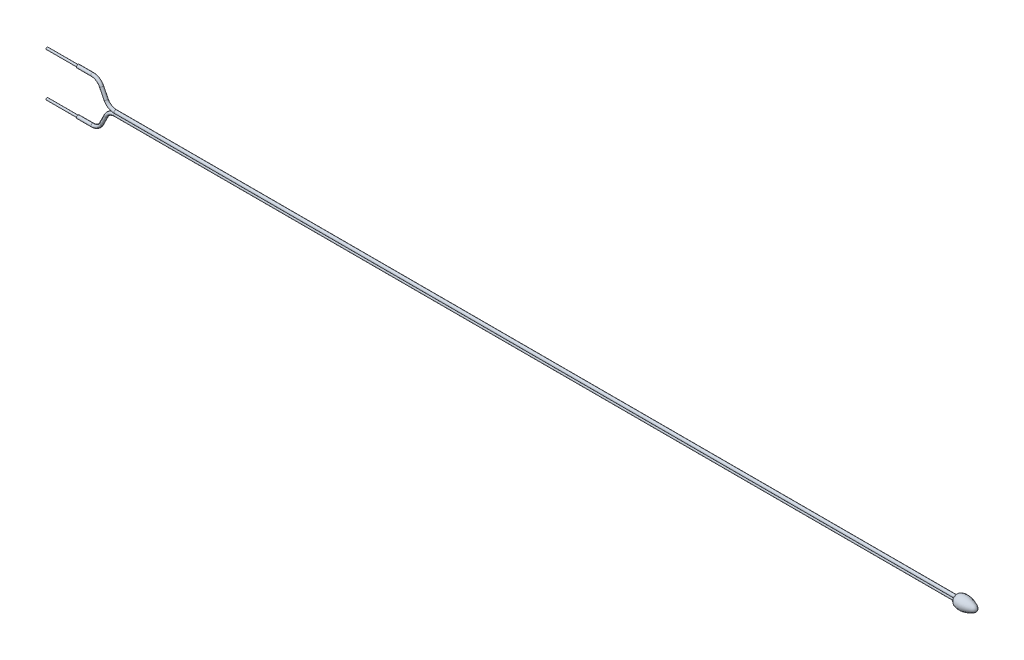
SolidWorks part; units mm, degrees
ref_plane "Спереди" through (0, 0, 0) normal (0, 0, 1) x (1, 0, 0)
ref_plane "Сверху" through (0, 0, 0) normal (0, 1, 0) x (1, 0, 0)
ref_plane "Справа" through (0, 0, 0) normal (1, 0, 0) x (0, 0, -1)
sketch "Эскиз1" plane through (0, 0, 0) normal (0, 0, 1) x (1, 0, 0)
  line L0 (0, 0) -> (0, 0.3)
  line L1 (0, 0) -> (2.1977, 0) construction
  line L2 (2, 0) -> (0, 0)
  spline S0 degree 3 poles (0, 0.3) (0.1151, 0.5518) (0.7679, 0.6612) (1.4471, 0.471) (1.9856, 0.2262) (2, 0) knots 0 0 0 0 0.344144 0.722891 1 1 1 1
  point P5 (0, 0)
  point P7 (0.0643, 0.3367)
  point P9 (0.0803, 0.4179)
  point P11 (0, 0)
  dimension "D1" = 0.3
  dimension "D2" = 2
  dimension "D3" = 0.6
  dimension "D4" = 0.7
revolve "Повернуть1" add sketch "Эскиз1" angle 360 about L1
sketch "Эскиз2" plane through (0, 0, 0) normal (0, 0, 1) x (1, 0, 0)
  line L0 (0, 0.12) -> (-81.382, 0.12)
  line L1 (0, 0.3) -> (0, -0.3) construction
  line L2 (-82.2764, 0.6728) -> (-82.7236, 1.5672)
  line L3 (-83.618, 2.12) -> (-88, 2.12)
  arc A0 (-82.7236, 1.5672) -> (-83.618, 2.12) centre (-83.618, 1.12) ccw
  arc A1 (-81.382, 0.12) -> (-82.2764, 0.6728) centre (-81.382, 1.12) cw
  point P9 (-83, 2.12)
  point P12 (-82, 0.12)
  dimension "D5" = 1
  dimension "D1" = 5
  dimension "D2" = 1
  dimension "D3" = 88
  dimension "D4" = 2
  dimension "D6" = 0.12
sketch "Эскиз3" plane through (0, 0, 0) normal (-1, 0, 0) x (0, 0, 1)
  circle A0 centre (0, 0.12) radius 0.15
  dimension "D1" = 0.3
sweep "По траектории1" add profiles "Эскиз3" path "Эскиз2"
sketch "Эскиз4" plane through (-88, 0, 0) normal (-1, 0, 0) x (0, 0, 1)
  circle A0 centre (0, 2.12) radius 0.1
  circle A1 centre (0, 2.12) radius 0.2231
  dimension "D1" = 0.2
extrude "Вырез-Вытянуть1" cut sketch "Эскиз4" against normal blind 3
mirror "Зеркальное отражение3" about plane through (0, 0, 0) normal (0, 1, 0) of "Вырез-Вытянуть1", "По траектории1"
